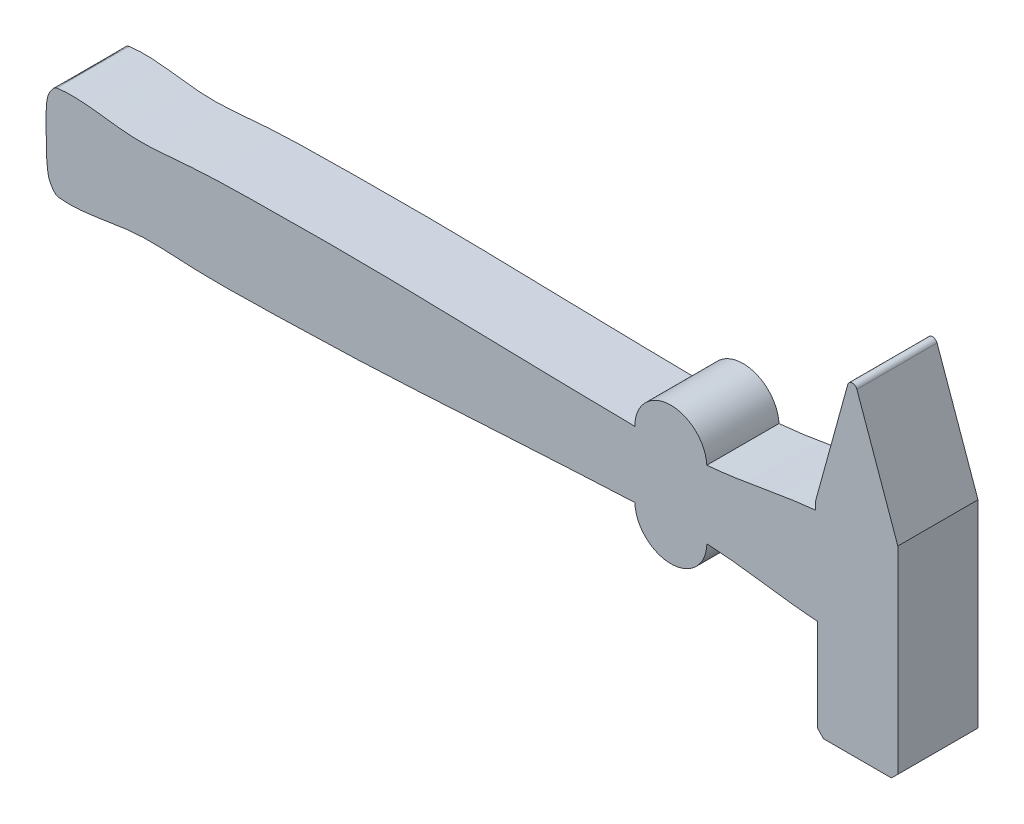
SolidWorks part; units mm, degrees
ref_plane "Plan de face" through (0, 0, 0) normal (0, 0, 1) x (1, 0, 0)
ref_plane "Plan de dessus" through (0, 0, 0) normal (0, 1, 0) x (1, 0, 0)
ref_plane "Plan de droite" through (0, 0, 0) normal (1, 0, 0) x (0, 0, -1)
sketch "Esquisse1" plane through (0, 0, 0) normal (0, 0, 1) x (1, 0, 0)
  line L0 (-388.3824, 105.6296) -> (139.5327, 89.0392) construction
  line L1 (0, 0) -> (0, 38.5055)
  line L2 (-284.6368, 70.5412) -> (-284.0031, 36.3588) construction
  line L3 (-284.32, 53.45) -> (83.1514, 59.7883) construction
  line L4 (0, 0) -> (2.5793, -2.6388)
  line L5 (2.5793, -2.6388) -> (30.8284, -2.6388)
  line L6 (30.8284, -2.6388) -> (33.5282, 0)
  line L7 (33.5282, 0) -> (33.5282, 82.3612)
  line L8 (33.5282, 82.3612) -> (14.3545, 136.3624)
  line L9 (14.3545, 136.3624) -> (-0.6845, 81.6961)
  line L10 (-0.6845, 81.6961) -> (-0.6845, 78.1908)
  spline S0 degree 3 poles (0, 38.5055) (-12.9929, 39.2651) (-32.8726, 43.1724) (-62.3228, 43.9918) (-92.949, 42.4953) (-137.6271, 40.0452) (-185.3014, 37.0157) (-228.8924, 35.9277) (-258.7667, 35.3214) (-283.1784, 37.5067) (-301.2471, 33.5502) (-312.0118, 32.8896) (-316.1547, 33.3659) knots 0 0 0 0 0.123174 0.190952 0.278444 0.413498 0.614695 0.730776 0.826275 0.897915 0.961055 1 1 1 1
  spline S1 degree 3 poles (-321.2186, 52.8135) (-321.2038, 49.4201) (-321.1659, 44.1912) (-320.2878, 37.7067) (-318.2147, 34.6903) (-316.9069, 33.4524) (-316.1547, 33.3659) knots 0 0 0 0 0.479345 0.759128 0.899247 1 1 1 1
  spline S2 degree 3 poles (-0.6845, 78.1908) (-13.6435, 76.9835) (-33.3766, 72.393) (-62.7811, 70.5584) (-93.4407, 70.9979) (-138.1766, 71.9057) (-185.927, 73.2892) (-229.5297, 72.8734) (-259.4071, 72.449) (-283.7289, 69.4231) (-301.9233, 72.7541) (-312.7044, 73.0431) (-316.8284, 72.4242) knots 0 0 0 0 0.123174 0.190952 0.278444 0.413498 0.614695 0.730776 0.826275 0.897915 0.961055 1 1 1 1
  spline S3 degree 3 poles (-321.2186, 52.8135) (-321.3208, 56.2054) (-321.4633, 61.4325) (-320.8093, 67.9435) (-318.8415, 71.0295) (-317.5772, 72.3118) (-316.8284, 72.4242) knots 0 0 0 0 0.479345 0.759128 0.899247 1 1 1 1
  dimension "D1" = 85
extrude "Boss.-Extru.1" add sketch "Esquisse1" along normal blind 33.4
fillet "Congé1" radius 2 1 edges at (14.3545, 136.3624, 16.7)
sketch "Esquisse3" plane through (0, 0, 0) normal (0, 0, -1) x (-1, 0, 0)
  line L0 (0.6845, 78.1908) -> (0, 38.5055)
  spline S0 degree 3 poles (1821.4053, 1371.5832) (234.0768, 135.7105) (329.4558, 105.4099) (320.2878, 37.7067) (311.9389, 25.5588) (284.8584, 23.9977) (-421.6905, 1891.8404) knots -8.489598 -8.489598 -8.489598 -8.489598 0.479345 0.759128 0.899247 2.576173 2.576173 2.576173 2.576173 only from (321.2186, 52.8135) to (316.1547, 33.3659) construction
  spline S1 degree 3 poles (-484.7359, -1759.6556) (285.8724, 82.8663) (312.8842, 80.3723) (320.8093, 67.9435) (327.6371, -0.036) (231.2688, -27.0292) (1775.056, -1316.9272) knots -1.57622 -1.57622 -1.57622 -1.57622 0.100753 0.240872 0.520655 9.489642 9.489642 9.489642 9.489642 only from (316.8284, 72.4242) to (321.2186, 52.8135) construction
  spline S2 degree 3 poles (565.7215, 2015.0683) (436.0771, 76.8606) (360.1971, 20.6419) (283.1784, 37.5067) (258.7667, 35.3214) (228.8924, 35.9277) (185.3014, 37.0157) (137.6271, 40.0452) (92.949, 42.4953) (62.3228, 43.9918) (-71.2563, 40.275) (-183.5802, -89.9499) (-497.8856, 1967.6109) knots -0.566785 -0.566785 -0.566785 -0.566785 0.038945 0.102085 0.173725 0.269224 0.385305 0.586502 0.721556 0.809048 0.876826 1.984512 1.984512 1.984512 1.984512 only from (316.1547, 33.3659) to (0, 38.5055) construction
  spline S3 degree 3 poles (-563.4396, -1832.6312) (-178.3577, 212.9022) (-70.5911, 78.8798) (62.7811, 70.5584) (93.4407, 70.9979) (138.1766, 71.9057) (185.927, 73.2892) (229.5297, 72.8734) (259.4071, 72.449) (283.7289, 69.4231) (361.2838, 83.6218) (435.1803, 24.8191) (497.9057, -1916.7394) knots -0.984518 -0.984518 -0.984518 -0.984518 0.123174 0.190952 0.278444 0.413498 0.614695 0.730776 0.826275 0.897915 0.961055 1.566789 1.566789 1.566789 1.566789 only from (0.6845, 78.1908) to (316.8284, 72.4242) construction
  spline S4 degree 3 poles (321.2186, 52.8135) (321.2038, 49.4201) (321.1659, 44.1912) (320.2878, 37.7067) (318.2147, 34.6903) (316.9069, 33.4524) (316.1547, 33.3659) knots 0 0 0 0 0.479345 0.759128 0.899247 1 1 1 1
  spline S5 degree 3 poles (316.8284, 72.4242) (317.5772, 72.3118) (318.8415, 71.0295) (320.8093, 67.9435) (321.4633, 61.4325) (321.3208, 56.2054) (321.2186, 52.8135) knots 0 0 0 0 0.100753 0.240872 0.520655 1 1 1 1
  spline S6 degree 3 poles (316.1547, 33.3659) (312.0118, 32.8896) (301.2471, 33.5502) (283.1784, 37.5067) (258.7667, 35.3214) (228.8924, 35.9277) (185.3014, 37.0157) (137.6271, 40.0452) (92.949, 42.4953) (62.3228, 43.9918) (32.8726, 43.1724) (12.9929, 39.2651) (0, 38.5055) knots 0 0 0 0 0.038945 0.102085 0.173725 0.269224 0.385305 0.586502 0.721556 0.809048 0.876826 1 1 1 1
  spline S7 degree 3 poles (0.6845, 78.1908) (13.6435, 76.9835) (33.3766, 72.393) (62.7811, 70.5584) (93.4407, 70.9979) (138.1766, 71.9057) (185.927, 73.2892) (229.5297, 72.8734) (259.4071, 72.449) (283.7289, 69.4231) (301.9233, 72.7541) (312.7044, 73.0431) (316.8284, 72.4242) knots 0 0 0 0 0.123174 0.190952 0.278444 0.413498 0.614695 0.730776 0.826275 0.897915 0.961055 1 1 1 1
extrude "Enlèv. mat.-Extru.1" cut sketch "Esquisse3" against normal blind 3.33
sketch "Esquisse5" plane through (0, 0, 33.4) normal (0, 0, 1) x (1, 0, 0)
  arc A0 (-46.0335, 71.7462) -> (-76.0101, 70.7875) centre (-61.0107, 70.9192) ccw
  arc A1 (-76.0053, 43.2873) -> (-46.0133, 43.4062) centre (-61.0107, 43.6889) ccw
  spline S0 degree 3 poles (-0.6845, 78.1908) (-13.6435, 76.9835) (-33.3766, 72.393) (-62.7811, 70.5584) (-93.4407, 70.9979) (-138.1766, 71.9057) (-185.927, 73.2892) (-229.5297, 72.8734) (-259.4071, 72.449) (-283.7289, 69.4231) (-301.9233, 72.7541) (-312.7044, 73.0431) (-316.8284, 72.4242) knots 0 0 0 0 0.123174 0.190952 0.278444 0.413498 0.614695 0.730776 0.826275 0.897915 0.961055 1 1 1 1 construction
  spline S1 degree 3 poles (-316.1547, 33.3659) (-312.0118, 32.8896) (-301.2471, 33.5502) (-283.1784, 37.5067) (-258.7667, 35.3214) (-228.8924, 35.9277) (-185.3014, 37.0157) (-137.6271, 40.0452) (-92.949, 42.4953) (-62.3228, 43.9918) (-32.8726, 43.1724) (-12.9929, 39.2651) (0, 38.5055) knots 0 0 0 0 0.038945 0.102085 0.173725 0.269224 0.385305 0.586502 0.721556 0.809048 0.876826 1 1 1 1 construction
  spline S2 degree 3 poles (-76.0053, 43.2873) (-70.7497, 43.5059) (-60.756, 43.8078) (-50.7464, 43.6424) (-46.0133, 43.4062) knots 0.759238 0.759238 0.759238 0.759238 0.809048 0.853913 0.853913 0.853913 0.853913
  spline S3 degree 3 poles (-46.0335, 71.7462) (-50.9105, 71.323) (-60.9085, 70.8051) (-70.9066, 70.7549) (-76.0101, 70.7875) knots 0.144605 0.144605 0.144605 0.144605 0.190952 0.23928 0.23928 0.23928 0.23928
  dimension "D1" = 30
extrude "Boss.-Extru.3" add sketch "Esquisse5" against normal up to surface (30.07 mm away)
